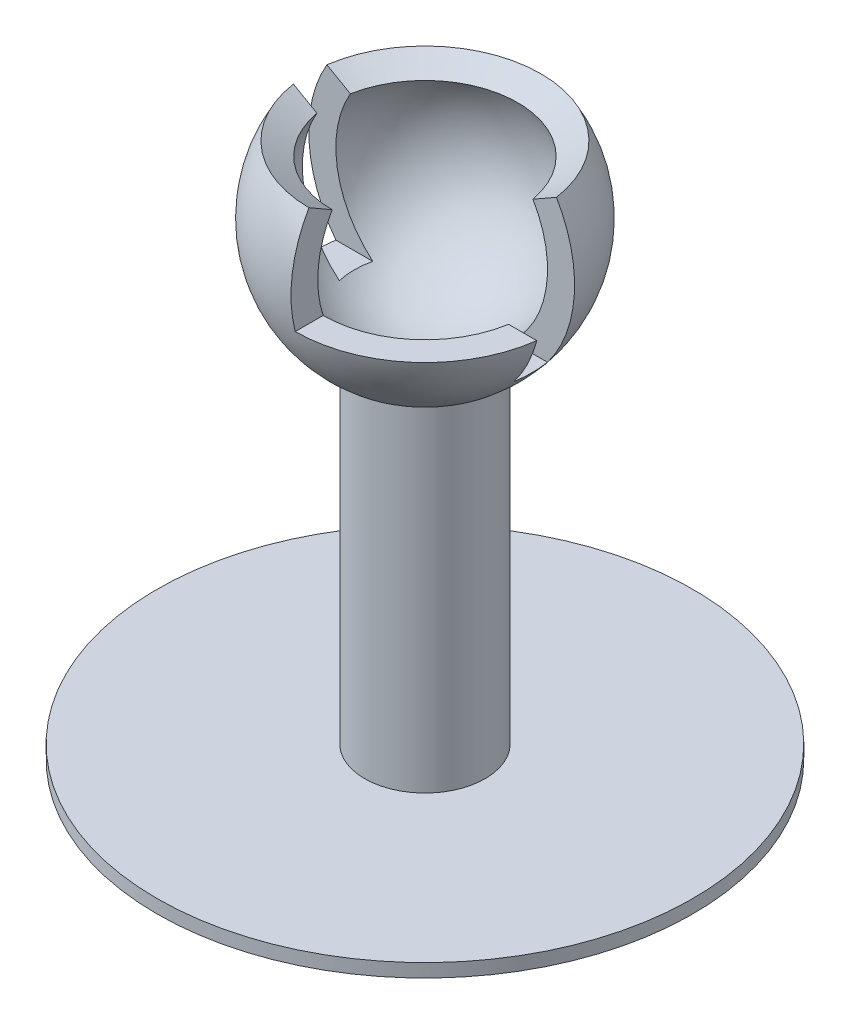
SolidWorks part; units mm, degrees
ref_plane "Plan de face" through (0, 0, 0) normal (0, 0, 1) x (1, 0, 0)
ref_plane "Plan de dessus" through (0, 0, 0) normal (0, 1, 0) x (1, 0, 0)
ref_plane "Plan de droite" through (0, 0, 0) normal (1, 0, 0) x (0, 0, -1)
sketch "Esquisse1" plane through (0, 0, 0) normal (0, 0, 1) x (1, 0, 0)
  line L0 (0, -16) -> (0, -20)
  line L1 (13.8564, 8) -> (17.3205, 10)
  line L2 (0, 21.4112) -> (0, -23.3838) construction
  arc A0 (0, -16) -> (13.8564, 8) centre (0, 0) ccw
  arc A1 (0, -20) -> (17.3205, 10) centre (0, 0) ccw
  dimension "D1" = 120
  dimension "D2" = 20
ref_plane "Plan1" through (0, -70, 0) normal (0, 1, 0) x (-1, 0, 0)
sketch "Esquisse2" plane through (0, -70, 0) normal (0, 1, 0) x (-1, 0, 0)
  circle A0 centre (0, 0) radius 40
extrude "Boss.-Extru.2" add sketch "Esquisse2" along normal blind 2 separate body
sketch "Esquisse3" plane through (0, -68, 0) normal (0, 1, 0) x (1, 0, 0)
  circle A0 centre (0, 0) radius 9
revolve "Révolution1" add sketch "Esquisse1" angle 360 about L2
extrude "Boss.-Extru.3" add sketch "Esquisse3" along normal up to surface (50.1394 mm away)
ref_plane "Plan2" through (0, 10, 0) normal (0, -1, 0) x (1, 0, 0)
sketch "Esquisse4" plane through (0, 10, 0) normal (0, -1, 0) x (1, 0, 0)
  line L1 (0, 0) -> (27.3948, 0)
  line L2 (0, 0) -> (0, 26.3098)
  line L3 (0, 26.3098) -> (27.3948, 26.3098)
  line L4 (27.3948, 0) -> (27.3948, 26.3098)
extrude "Enlèv. mat.-Extru.1" cut sketch "Esquisse4" along normal blind 15
sketch "Esquisse6" plane through (0, 0, 0) normal (0, 0, 1) x (1, 0, 0)
  line L0 (-16, -12) -> (16, -12)
  line L1 (-17.3205, 10) -> (17.3205, 10)
  line L2 (-19.0526, 10) -> (19.0526, 10) construction
  arc A0 (-17.3205, 10) -> (-16, -12) centre (0, 0) ccw
  arc A1 (16, -12) -> (17.3205, 10) centre (0, 0) ccw
  dimension "D1" = 12
extrude "Enlèv. mat.-Extru.2" cut sketch "Esquisse6" against normal mid plane 5
